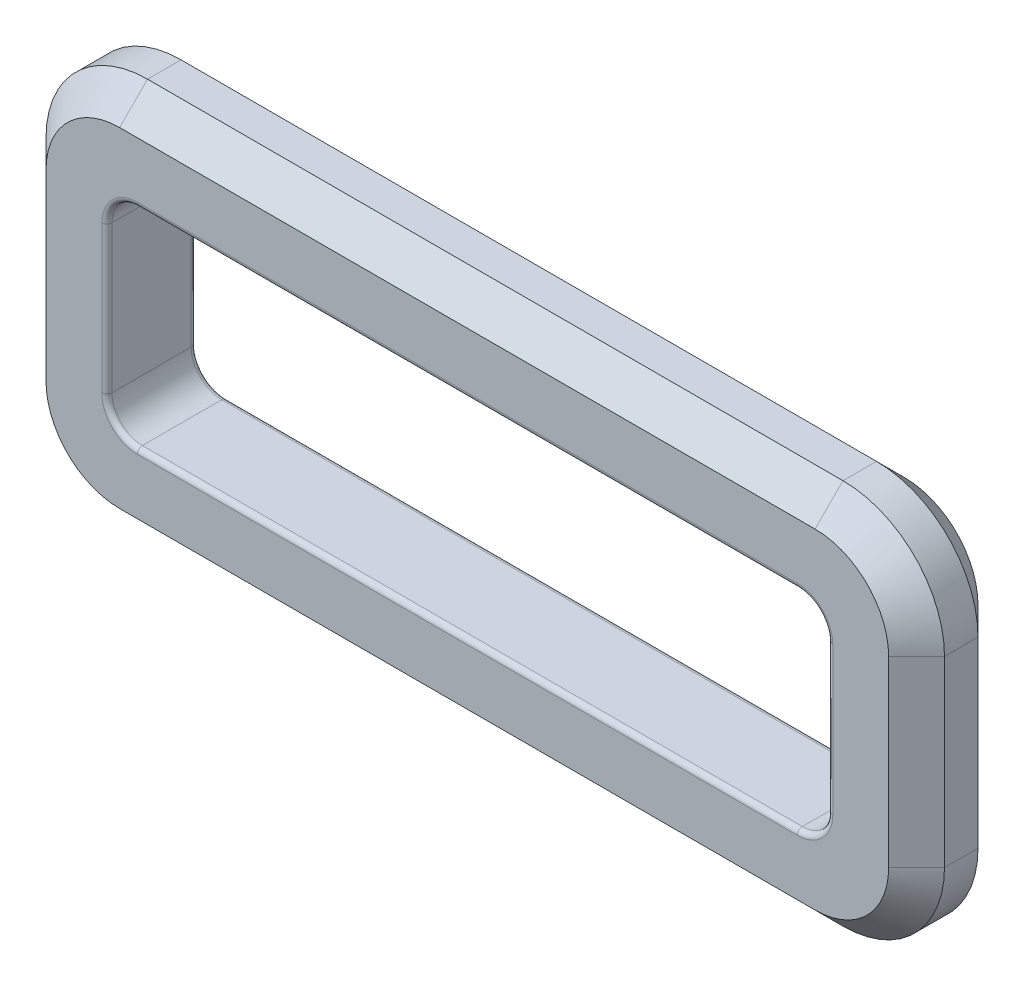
SolidWorks part; units mm, degrees
ref_plane "Front Plane" through (0, 0, 0) normal (0, 0, 1) x (1, 0, 0)
ref_plane "Top Plane" through (0, 0, 0) normal (0, 1, 0) x (1, 0, 0)
ref_plane "Right Plane" through (0, 0, 0) normal (1, 0, 0) x (0, 0, -1)
sketch "Sketch1" plane through (0, 0, 0) normal (0, 0, 1) x (1, 0, 0)
  line L1 (-3.25, -1.025) -> (3.25, -1.025)
  line L2 (-3.55, -0.725) -> (-3.55, 0.725)
  line L3 (-3.25, 1.025) -> (3.25, 1.025)
  line L4 (3.55, -0.725) -> (3.55, 0.725)
  line L5 (-3.55, -1.025) -> (3.55, 1.025) construction
  line L6 (-3.55, 1.025) -> (3.55, -1.025) construction
  line L7 (-3.425, -1.9) -> (3.425, -1.9)
  line L8 (-4.425, -0.9) -> (-4.425, 0.9)
  line L9 (-3.425, 1.9) -> (3.425, 1.9)
  line L10 (4.425, -0.9) -> (4.425, 0.9)
  line L11 (-4.425, -1.9) -> (4.425, 1.9) construction
  line L12 (-4.425, 1.9) -> (4.425, -1.9) construction
  arc A0 (3.25, 1.025) -> (3.55, 0.725) centre (3.25, 0.725) cw
  arc A1 (3.25, -1.025) -> (3.55, -0.725) centre (3.25, -0.725) ccw
  arc A2 (-3.25, -1.025) -> (-3.55, -0.725) centre (-3.25, -0.725) cw
  arc A3 (-3.55, 0.725) -> (-3.25, 1.025) centre (-3.25, 0.725) cw
  arc A4 (3.425, -1.9) -> (4.425, -0.9) centre (3.425, -0.9) ccw
  arc A5 (3.425, 1.9) -> (4.425, 0.9) centre (3.425, 0.9) cw
  arc A6 (-3.425, -1.9) -> (-4.425, -0.9) centre (-3.425, -0.9) cw
  arc A7 (-4.425, 0.9) -> (-3.425, 1.9) centre (-3.425, 0.9) cw
  point P0 (0, 0)
  point P6 (0, 0)
  dimension "D5" = 0.3
  dimension "D6" = 1
  dimension "D1" = 7.1
  dimension "D2" = 2.05
  dimension "D3" = 8.85
  dimension "D4" = 3.8
extrude "Boss-Extrude1" add sketch "Sketch1" along normal blind 0.88
fillet "Fillet1" radius 0.05 16 edges at (-3.4621, 0.9371, 0.88) (0, 1.025, 0.88) (3.4621, 0.9371, 0.88) (3.55, 0, 0.88) (3.4621, -0.9371, 0.88) (0, -1.025, 0.88) (-3.4621, -0.9371, 0.88) (-3.55, 0, 0.88) (-3.4621, 0.9371, 0) (0, 1.025, 0) (3.4621, 0.9371, 0) (3.55, 0, 0) (3.4621, -0.9371, 0) (0, -1.025, 0) (-3.4621, -0.9371, 0) (-3.55, 0, 0)
chamfer "Chamfer1" distance 0.275 16 edges at (0, -1.9, 0) (4.1321, -1.6071, 0) (-4.1321, -1.6071, 0) (4.425, 0, 0) (-4.425, 0, 0) (4.1321, 1.6071, 0) (-4.1321, 1.6071, 0) (0, 1.9, 0) (0, -1.9, 0.88) (4.1321, -1.6071, 0.88) (-4.1321, -1.6071, 0.88) (4.425, 0, 0.88) (-4.425, 0, 0.88) (4.1321, 1.6071, 0.88) (-4.1321, 1.6071, 0.88) (0, 1.9, 0.88)
